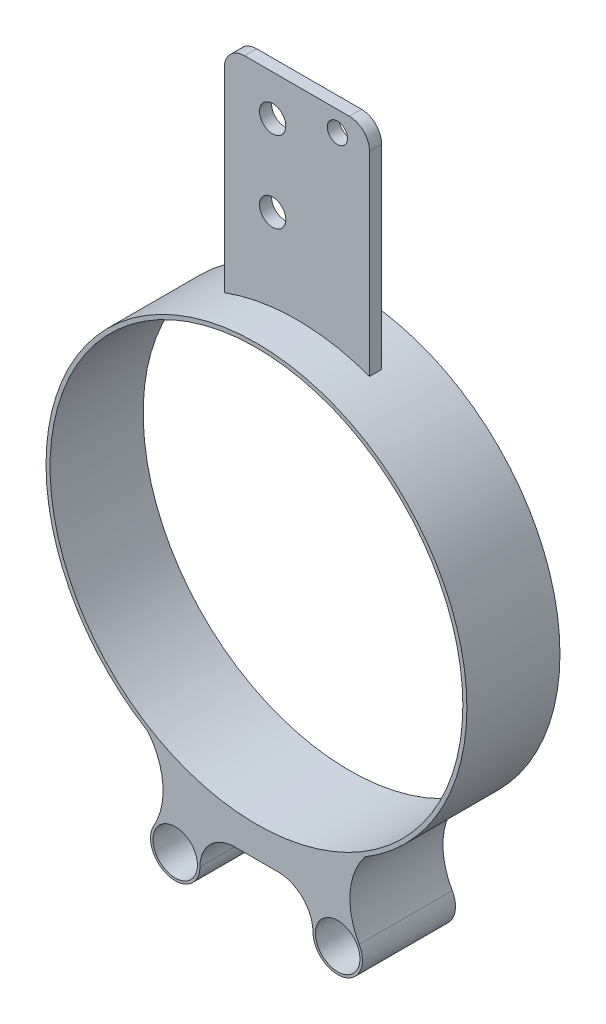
SolidWorks part; units mm, degrees
ref_plane "Plan de face" through (0, 0, 0) normal (0, 0, 1) x (1, 0, 0)
ref_plane "Plan de dessus" through (0, 0, 0) normal (0, 1, 0) x (1, 0, 0)
ref_plane "Plan de droite" through (0, 0, 0) normal (1, 0, 0) x (0, 0, -1)
sketch "Esquisse1" plane through (0, 0, 0) normal (0, 0, 1) x (1, 0, 0)
  line L0 (0, 67.3813) -> (0, -66.2156) construction
  line L1 (-5.2638, -58.5215) -> (5.2638, -58.5215)
  circle A0 centre (0, 0) radius 51
  arc A1 (26.8345, -44.5411) -> (-26.8345, -44.5411) centre (0, 0) ccw
  arc A2 (-5.2638, -58.5215) -> (-13.9659, -67.0791) centre (-5.3395, -67.1479) ccw
  arc A3 (-13.9659, -67.0791) -> (-25.3779, -63.999) centre (-20.0744, -67.0304) cw
  arc A4 (-25.3779, -63.999) -> (-26.8345, -44.5411) centre (-40.5125, -55.3485) ccw
  arc A5 (25.3779, -63.999) -> (26.8345, -44.5411) centre (40.5125, -55.3485) cw
  arc A6 (13.9659, -67.0791) -> (25.3779, -63.999) centre (20.0744, -67.0304) ccw
  arc A7 (5.2638, -58.5215) -> (13.9659, -67.0791) centre (5.3395, -67.1479) cw
  point P21 (0, -58.5215)
  dimension "D1" = 102
  dimension "D2" = 104
extrude "Extrusion1" add sketch "Esquisse1" along normal blind 23
ref_plane "Plan2" through (0, 0, 11.5) normal (0, 0, 1) x (1, 0, 0)
sketch "Esquisse2" plane through (0, 0, 11.5) normal (0, 0, 1) x (1, 0, 0)
  line L0 (0, -20.5712) -> (0, 98.3659) construction
  line L1 (17.9396, 48.8075) -> (-17.9396, 48.8075)
  line L2 (17.9396, 48.8075) -> (17.9396, 97)
  line L3 (12.9396, 102) -> (-12.9396, 102)
  line L4 (-17.9396, 48.8075) -> (-17.9396, 97)
  arc A0 (26.8345, -44.5411) -> (-26.8345, -44.5411) centre (0, 0) ccw construction
  arc A1 (26.8345, -44.5411) -> (-26.8345, -44.5411) centre (0, 0) ccw
  arc A2 (-12.9396, 102) -> (-17.9396, 97) centre (-12.9396, 97) ccw
  arc A3 (17.9396, 97) -> (12.9396, 102) centre (12.9396, 97) ccw
  circle A4 centre (10, 97) radius 2.5
  circle A5 centre (-6, 92) radius 3.25
  circle A6 centre (-6, 72) radius 3.25
  point P10 (0, 52)
  point P23 (-16.8592, 78.9704)
  dimension "D2" = 5
  dimension "D5" = 5
  dimension "D6" = 6.5
  dimension "D7" = 6.5
  dimension "D1" = 50
  dimension "D3" = 10
  dimension "D4" = 20
  dimension "D8" = 10
  dimension "D9" = 5
  dimension "D10" = 6
extrude "Extrusion2" add sketch "Esquisse2" along normal mid plane 3
sketch "Esquisse3" plane through (0, 0, 23) normal (0, 0, 1) x (1, 0, 0)
  circle A0 centre (-20.0744, -67.0304) radius 5.5
  circle A1 centre (20.0744, -67.0304) radius 5.5
  dimension "D1" = 11
  dimension "D2" = 11
extrude "Extrusion3" cut sketch "Esquisse3" against normal blind 25
